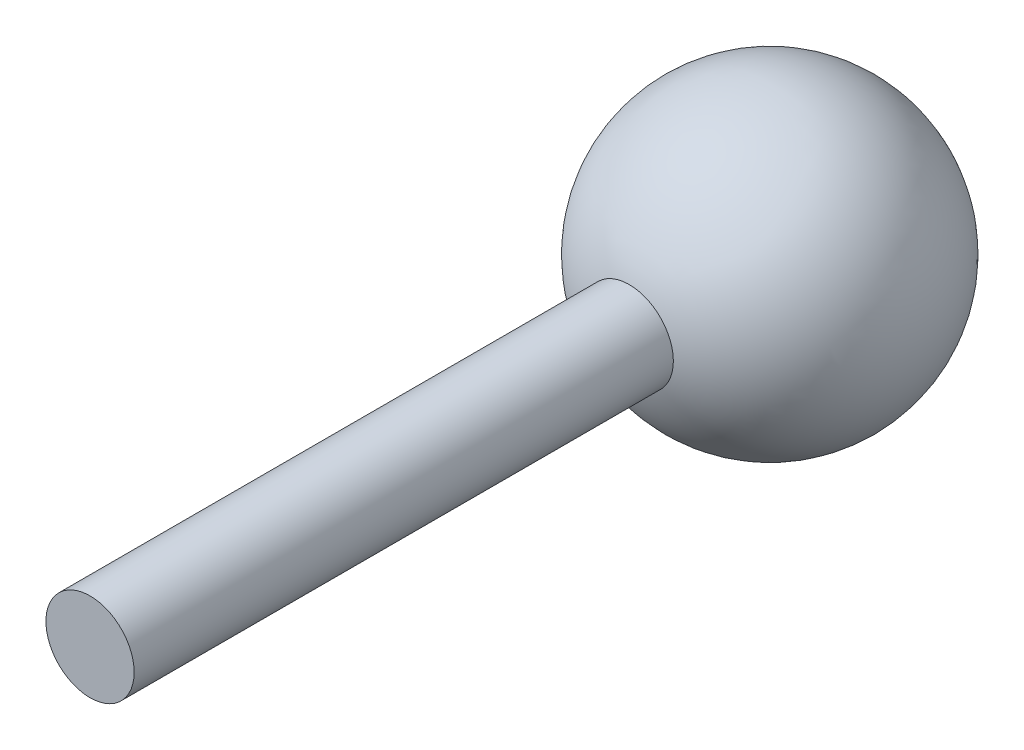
SolidWorks part; units mm, degrees
ref_plane "Ebene1" through (0, 0, 0) normal (0, 0, 1) x (1, 0, 0)
ref_plane "Ebene2" through (0, 0, 0) normal (0, 1, 0) x (1, 0, 0)
ref_plane "Ebene3" through (0, 0, 0) normal (1, 0, 0) x (0, 0, -1)
sketch "Skizze1" plane through (0, 0, 0) normal (0, 1, 0) x (1, 0, 0)
  line L0 (0, 0) -> (0, -65.4768)
  line L1 (0, -65.4768) -> (3.4934, -65.4768)
  line L2 (3.4934, -65.4768) -> (3.4934, -22.7858)
  line L3 (0, 0) -> (0, 9.1468) construction
  arc A0 (0, 0) -> (3.4934, -22.7858) centre (0, -11.6607) cw
revolve "Rotation1" add sketch "Skizze1" angle 360 about L3
